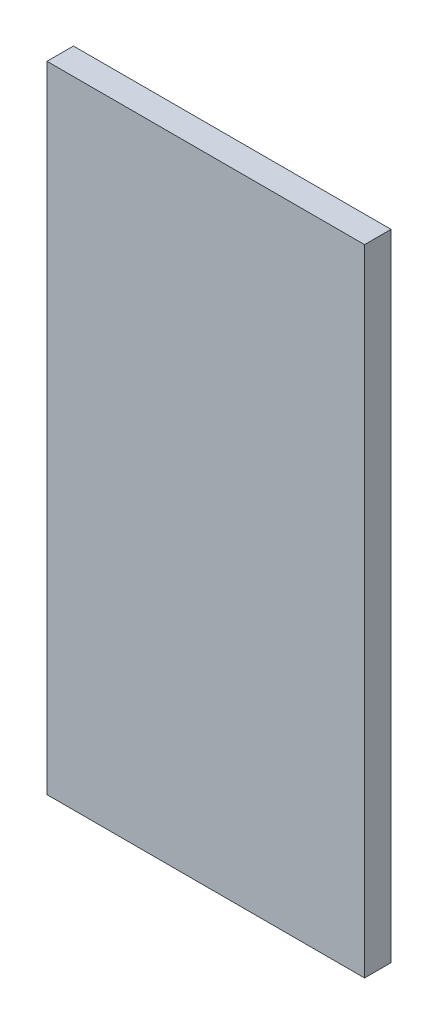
SolidWorks part; units mm, degrees
ref_plane "Front Plane" through (0, 0, 0) normal (0, 0, 1) x (1, 0, 0)
ref_plane "Top Plane" through (0, 0, 0) normal (0, 1, 0) x (1, 0, 0)
ref_plane "Right Plane" through (0, 0, 0) normal (1, 0, 0) x (0, 0, -1)
sketch "Sketch1" plane through (0, 0, 0) normal (1, 0, 0) x (0, 0, -1)
  line L0 (0, 0) -> (0, 1219.2)
  line L1 (0, 1219.2) -> (50.8, 1219.2)
  line L2 (50.8, 1219.2) -> (50.8, 1168.4)
  line L3 (50.8, 1168.4) -> (101.6, 1168.4)
  line L4 (101.6, 1168.4) -> (101.6, 50.8)
  line L5 (101.6, 50.8) -> (50.8, 50.8)
  line L6 (50.8, 50.8) -> (50.8, 0)
  line L7 (50.8, 0) -> (0, 0)
  dimension "D1" = 1117.6
  dimension "D2" = 1219.2
  dimension "D3" = 50.8
  dimension "D4" = 50.8
  dimension "D5" = 50.8
extrude "Boss-Extrude1" add sketch "Sketch1" along normal blind 609.6
sketch "Sketch3" plane through (0, 1168.4, 0) normal (0, 1, 0) x (1, 0, 0)
  line L0 (609.6, 101.6) -> (0, 101.6) construction
  line L1 (609.6, 50.8) -> (533.4, 50.8)
  line L2 (609.6, 50.8) -> (609.6, 101.6)
  line L3 (609.6, 101.6) -> (533.4, 101.6)
  line L4 (533.4, 50.8) -> (533.4, 101.6)
  dimension "D1" = 76.2
extrude "Cut-Extrude1" cut sketch "Sketch3" against normal up to next
